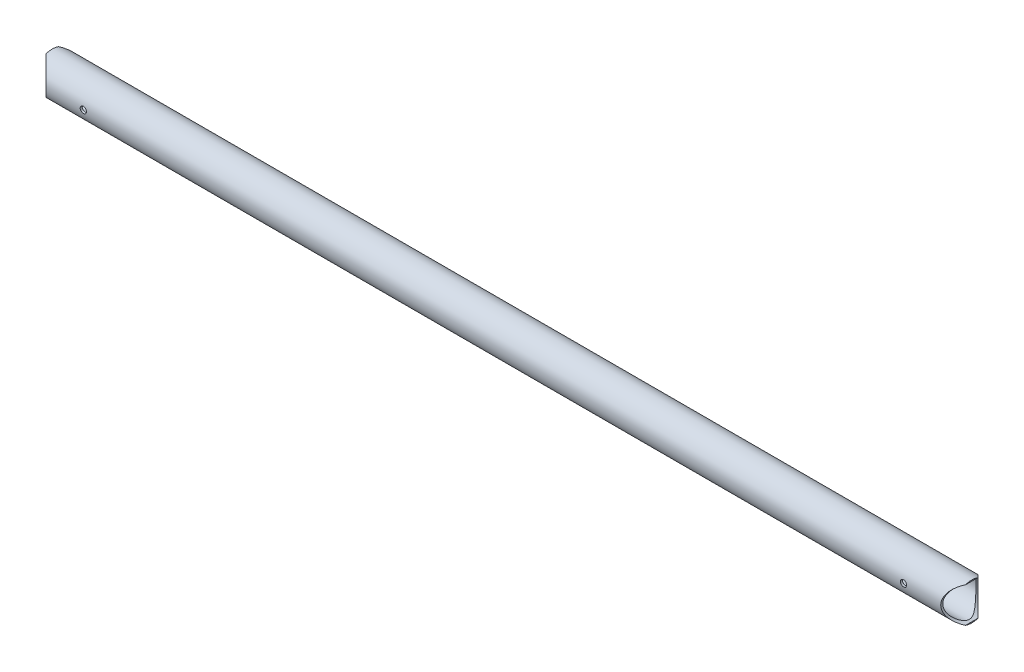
SolidWorks part; units mm, degrees
ref_plane "Front Plane" through (0, 0, 0) normal (0, 0, 1) x (1, 0, 0)
ref_plane "Top Plane" through (0, 0, 0) normal (0, 1, 0) x (1, 0, 0)
ref_plane "Right Plane" through (0, 0, 0) normal (1, 0, 0) x (0, 0, -1)
sketch "Sketch1" plane through (0, 0, 0) normal (1, 0, 0) x (0, 0, -1)
  circle A0 centre (0, 0) radius 19.05
  circle A1 centre (0, 0) radius 16.9418
  dimension "D1" = 38.1
  dimension "D2" = 2.1082
extrude "Extrude1" add sketch "Sketch1" along normal mid plane 939.8
sketch "Sketch2" plane through (0, 0, 0) normal (0, 0, 1) x (1, 0, 0)
  line L0 (-488.1759, 0) -> (624.846, 0) construction
  line L1 (-469.9, 19.05) -> (-469.9, -19.05) construction
  circle A0 centre (-476.25, 0) radius 19.05
  circle A1 centre (476.25, 0) radius 19.05
  dimension "D1" = 38.1
  dimension "D2" = 6.35
  dimension "D3" = 38.1
  dimension "D4" = 952.5
extrude "Extrude2" cut sketch "Sketch2" against normal through all and the other way through all
sketch "Sketch3" plane through (0, 0, 0) normal (0, 0, 1) x (1, 0, 0)
  line L0 (-398.3467, 0) -> (413.514, 0) construction
  line L1 (-469.9, 19.05) -> (-469.9, 17.9605) construction
  circle A0 centre (-419.1, 0) radius 3.175
  circle A1 centre (419.1, 0) radius 3.175
  dimension "D1" = 6.35
  dimension "D2" = 6.35
  dimension "D3" = 50.8
  dimension "D4" = 889
extrude "Extrude3" cut sketch "Sketch3" against normal through all and the other way through all
